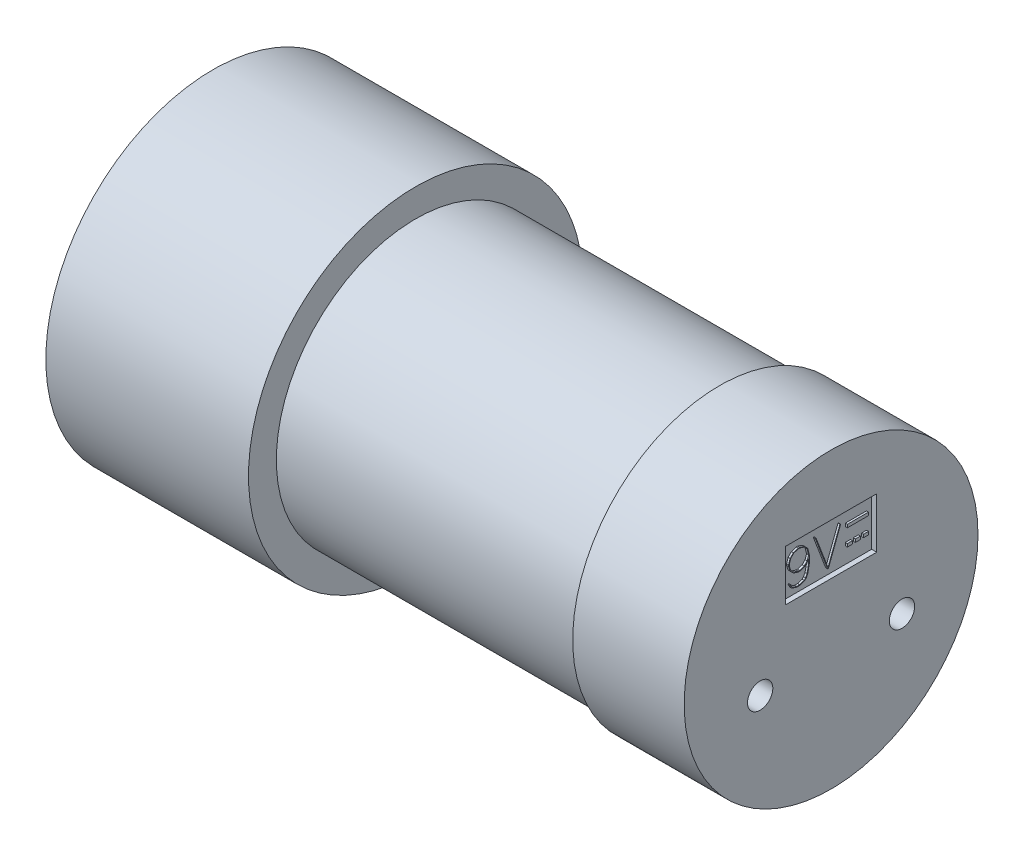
SolidWorks part; units mm, degrees
ref_plane "前视基准面" through (0, 0, 0) normal (0, 0, 1) x (1, 0, 0)
ref_plane "上视基准面" through (0, 0, 0) normal (0, 1, 0) x (1, 0, 0)
ref_plane "右视基准面" through (0, 0, 0) normal (1, 0, 0) x (0, 0, -1)
sketch "草图1" plane through (0, 0, 0) normal (1, 0, 0) x (0, 0, -1)
  circle A0 centre (0, 0) radius 16.5
  dimension "D1" = 33
extrude "凸台-拉伸1" add sketch "草图1" along normal blind 20
sketch "草图2" plane through (20, 0, 0) normal (1, 0, 0) x (0, 0, -1)
  circle A0 centre (0, 0) radius 13.75
  dimension "D1" = 27.5
extrude "凸台-拉伸2" add sketch "草图2" along normal blind 30
sketch "草图3" plane through (50, 0, 0) normal (1, 0, 0) x (0, 0, -1)
  circle A0 centre (0, 0) radius 14.5
  dimension "D1" = 29
extrude "凸台-拉伸3" add sketch "草图3" along normal blind 11
sketch "草图4" plane through (61, 0, 0) normal (1, 0, 0) x (0, 0, -1)
  line L0 (0, 14.5) -> (0, 8.5) construction
  line L1 (0, 8.5) -> (0, 6) construction
  line L2 (4.5, 3.5) -> (4.5, 8.5)
  line L3 (4.5, 3.5) -> (-4.5, 3.5)
  line L4 (4.5, 8.5) -> (-4.5, 8.5)
  line L5 (-4.5, 3.5) -> (-4.5, 8.5)
  line L6 (4.5, 3.5) -> (-4.5, 8.5) construction
  line L7 (4.5, 8.5) -> (-4.5, 3.5) construction
  circle A0 centre (0, 0) radius 14.5 construction
  dimension "D1" = 6
  dimension "D2" = 2.5
  dimension "D3" = 5
  dimension "D4" = 9
extrude "切除-拉伸1" cut sketch "草图4" against normal blind 0.5
sketch "草图5" plane through (60.5, 0, 0) normal (1, 0, 0) x (0, 0, -1)
  line L0 (-4.5, 4.2) -> (4.5, 4.2) construction
  line L1 (-4.5, 8.5) -> (-4.5, 3.5) construction
  line L2 (4.5, 3.5) -> (4.5, 8.5) construction
  line L3 (-4.5, 3.5) -> (4.5, 3.5) construction
  line L4 (4.5, 3.5) -> (4.5, 8.5) construction
  line L5 (1.9, 6.7331) -> (4, 6.7331)
  line L6 (1.9, 6.7331) -> (1.9, 7.0331)
  line L7 (1.9, 7.0331) -> (4, 7.0331)
  line L8 (4, 6.7331) -> (4, 7.0331)
  line L9 (1.9, 5.3869) -> (2.4, 5.3869)
  line L10 (1.9, 5.3869) -> (1.9, 5.0869)
  line L11 (1.9, 5.0869) -> (2.4, 5.0869)
  line L12 (2.4, 5.3869) -> (2.4, 5.0869)
  line L13 (2.7, 5.3869) -> (3.2, 5.3869)
  line L14 (2.7, 5.3869) -> (2.7, 5.0869)
  line L15 (2.7, 5.0869) -> (3.2, 5.0869)
  line L16 (3.2, 5.3869) -> (3.2, 5.0869)
  line L17 (3.5, 5.3869) -> (4, 5.3869)
  line L18 (3.5, 5.3869) -> (3.5, 5.0869)
  line L19 (3.5, 5.0869) -> (4, 5.0869)
  line L20 (4, 5.3869) -> (4, 5.0869)
  text T0 "9V" font "RomanS" height in points 9
  dimension "D1" = 0.7
  dimension "D2" = 0.5
  dimension "D3" = 2.1
  dimension "D4" = 0.3
  dimension "D5" = 0.3
  dimension "D6" = 0.3
  dimension "D7" = 0.3
  dimension "D8" = 0.5
  dimension "D9" = 0.5
  dimension "D10" = 0.5
  dimension "D11" = 0.3
  dimension "D12" = 0.3
  dimension "D13" = 0.5
wrap "包覆1" sketch "草图5" wrap type emboss source sketch "草图5" thickness 0.2 parameters "D1"=0.2
sketch "草图6" plane through (61, 0, 0) normal (1, 0, 0) x (0, 0, -1)
  line L0 (0, 0) -> (0, -3) construction
  line L1 (7, -3) -> (-7, -3) construction
  circle A0 centre (-7, -3) radius 1.25
  circle A1 centre (7, -3) radius 1.25
  dimension "D3" = 2.5
  dimension "D1" = 3
  dimension "D2" = 7
extrude "切除-拉伸2" cut sketch "草图6" against normal blind 6
sketch "草图7" plane through (0, 0, 0) normal (-1, 0, 0) x (0, 0, 1)
  line L0 (0, 0) -> (0, -6) construction
  arc A0 (6.3246, -9) -> (-6.3246, -9) centre (0, 0) ccw
  circle A1 centre (0, 0) radius 16.5 construction
  arc A2 (6.3246, -9) -> (-6.3246, -9) centre (0, -6) ccw
  dimension "D1" = 22
  dimension "D2" = 33
  dimension "D4" = 14
  dimension "D3" = 6
extrude "切除-拉伸3" cut sketch "草图7" against normal blind 0.5
sketch "草图8" plane through (0, 0, 0) normal (-1, 0, 0) x (0, 0, 1)
  circle A0 centre (0, -6) radius 5
  dimension "D1" = 10
extrude "凸台-拉伸4" add sketch "草图8" along normal blind 2.5
sketch "草图9" plane through (-2.5, 0, 0) normal (-1, 0, 0) x (0, 0, 1)
  circle A0 centre (0, -6) radius 3
  dimension "D1" = 6
extrude "切除-拉伸4" cut sketch "草图9" against normal blind 2
sketch "草图10" plane through (-0.5, 0, 0) normal (-1, 0, 0) x (0, 0, 1)
  circle A0 centre (0, -6) radius 2.5
  dimension "D1" = 5
extrude "凸台-拉伸5" add sketch "草图10" along normal blind 11.5
sketch "草图11" plane through (-12, 0, 0) normal (-1, 0, 0) x (0, 0, 1)
  line L0 (0, -6) -> (0, -4.5) construction
  line L1 (0, -4.5) -> (-2, -4.5)
  line L2 (0, -4.5) -> (2, -4.5)
  arc A0 (2, -4.5) -> (-2, -4.5) centre (0, -6) ccw
  dimension "D2" = 2.5
  dimension "D1" = 1.5
extrude "切除-拉伸5" cut sketch "草图11" against normal blind 7
sketch "草图12" plane through (0, 0, 0) normal (-1, 0, 0) x (0, 0, 1)
  line L0 (0, 0) -> (0, 13.4) construction
  dimension "D1" = 13.4
hole_wizard "M3 螺纹孔1" positions "3D草图1" profile "草图13" tap size "M3" standard "Iso"
sketch3d "3D草图1"
  point P0 (0, 13.4, 0)
sketch "草图13" plane through (0, 13.4, 0) normal (0, 1, 0) x (0, 0, 1)
  line L0 (0, 0) -> (0, 10.7511)
  line L1 (0, 10.7511) -> (1.25, 10)
  line L2 (1.25, 10) -> (1.25, 1.0864)
  line L3 (1.25, 1.0864) -> (1.7, 0)
  line L5 (1.7, 0) -> (0, 0)
  line L6 (-1.25, 1.0864) -> (-1.7, 0) construction
  line L10 (0, 10.7511) -> (-1.25, 10) construction
  line L11 (0, -6.35) -> (0, 107.95) construction
  dimension "螺纹孔钻头直径" = 2.5
  dimension "螺纹孔钻头深度" = 10
  dimension "近端锥形沉头孔直径" = 3.4
  dimension "近端锥形沉头孔角度" = 45
  dimension "导头角度" = 118
